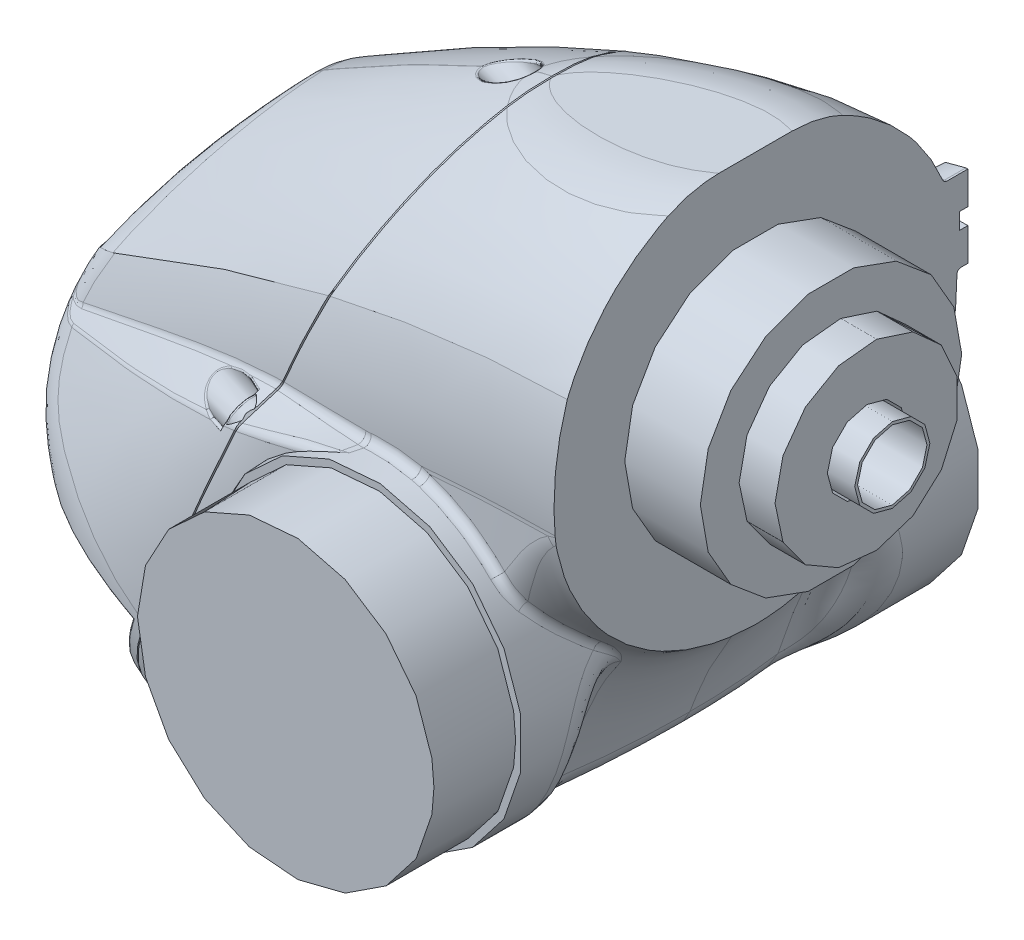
SolidWorks part; units mm, degrees
ref_plane "Front" through (0, 0, 0) normal (0, 0, 1) x (1, 0, 0)
ref_plane "Top" through (0, 0, 0) normal (0, 1, 0) x (1, 0, 0)
ref_plane "Right" through (0, 0, 0) normal (1, 0, 0) x (0, 0, -1)
imported_body "Imported1"
sketch "Schizzo1" plane through (0, 0, 54.5) normal (0, 0, 1) x (1, 0, 0)
  circle A0 centre (0, 0) radius 36.2907
  dimension "D1" = 72.5814
extrude "Estrusione-Estrusione1" add sketch "Schizzo1" along normal blind 20
